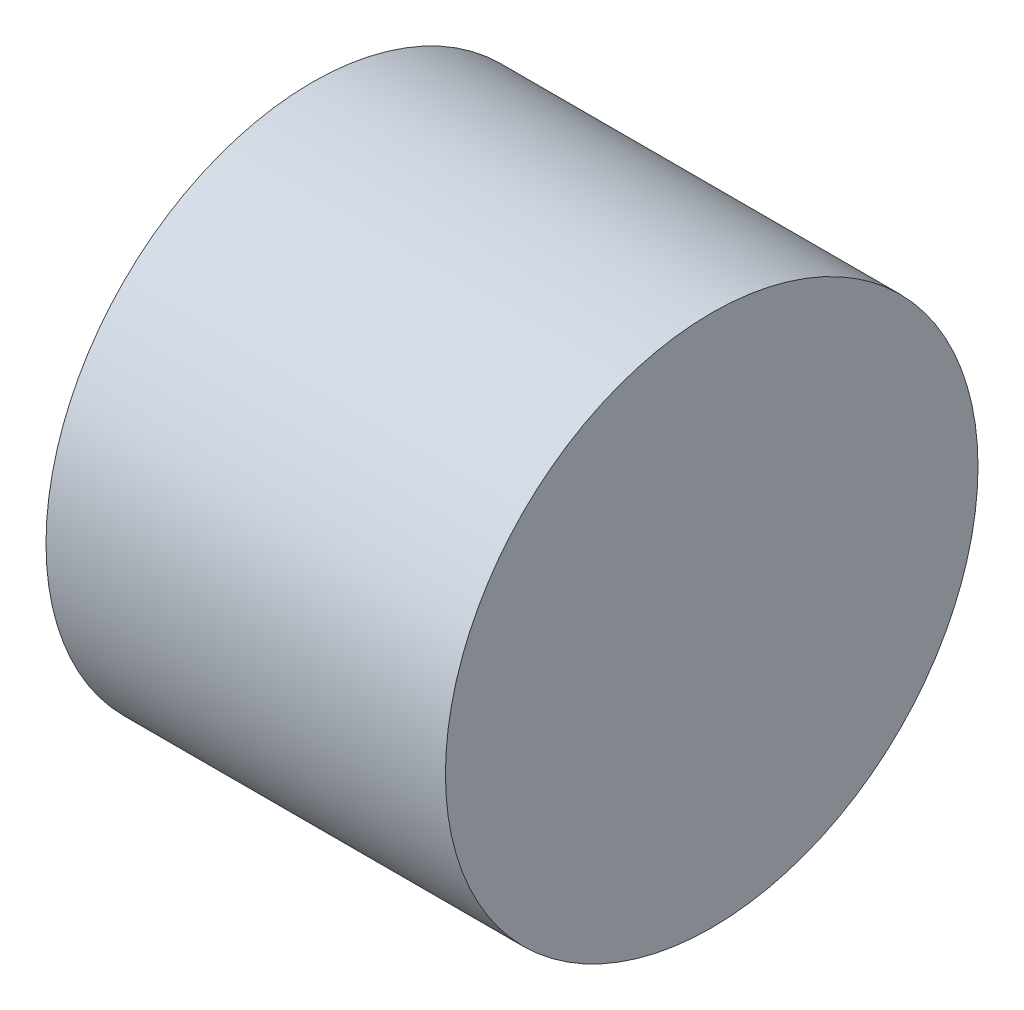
SolidWorks part; units mm, degrees
ref_plane "Plan de face" through (0, 0, 0) normal (0, 0, 1) x (1, 0, 0)
ref_plane "Plan de dessus" through (0, 0, 0) normal (0, 1, 0) x (1, 0, 0)
ref_plane "Plan de droite" through (0, 0, 0) normal (1, 0, 0) x (0, 0, -1)
sketch "Esquisse2" plane through (0, 0, 0) normal (0, 0, 1) x (1, 0, 0)
  line L0 (-39.9719, 0) -> (97.2999, 0) construction
  line L1 (0, 0) -> (60, 0)
  line L2 (0, 0) -> (0, 40)
  line L3 (0, 40) -> (60, 40)
  line L4 (60, 0) -> (60, 40)
  dimension "D1" = 80
  dimension "D2" = 60
revolve "Révolution1" add sketch "Esquisse2" angle 360 about L0
sketch "Esquisse8" [suppressed] plane through (0, 0, 0) normal (0, 0, 1) x (1, 0, 0)
  line L0 (-12.5108, 0) -> (75.6947, 0) construction
  line L1 (33, 46.031) -> (33, 18)
  line L2 (33, 18) -> (59, 18)
  line L3 (59, 18) -> (59, 0)
  line L4 (59, 0) -> (67.631, 0)
  line L5 (67.631, 0) -> (67.631, 50.3229)
  line L6 (67.631, 50.3229) -> (33, 46.031)
  line L8 (60, -40) -> (60, 40) construction
  dimension "D1" = 36
  dimension "D2" = 1
  dimension "D3" = 26
revolve "Enlèvement de matière-Révolution2" [suppressed] cut sketch "Esquisse8" angle 360 about L0
sketch "Esquisse9" [suppressed] plane through (59, 0, 0) normal (1, 0, 0) x (0, 0, -1)
  circle A0 centre (0, 0) radius 8.275
  circle A1 centre (0, 0) radius 18 construction
  dimension "D1" = 16.55
extrude "Enlèv. mat.-Extru.1" [suppressed] cut sketch "Esquisse9" against normal through all
sketch "Esquisse10" plane through (0, 0, 0) normal (0, 0, 1) x (1, 0, 0)
  line L0 (35.3128, 37) -> (22.475, 37)
  line L1 (22.475, 37) -> (22.475, 16)
  line L2 (22.475, 16) -> (1.5, 16)
  line L3 (1.5, 16) -> (1.5, 9.01)
  line L4 (1.5, 9.01) -> (16.5, 9.01)
  line L5 (16.5, 9.01) -> (16.5, 0)
  line L7 (16.5, 0) -> (-6.9066, 0)
  line L8 (-6.9066, 0) -> (-6.9066, 43.7491)
  line L9 (-6.9066, 43.7491) -> (35.3128, 43.7491)
  line L10 (35.3128, 43.7491) -> (35.3128, 37)
  line L11 (71.8724, 0) -> (-25.2629, 0) construction
  line L12 (0, 40) -> (0, -40) construction
  dimension "D1" = 18.02
  dimension "D2" = 32
  dimension "D3" = 74
  dimension "D4" = 1.5
  dimension "D5" = 20.975
  dimension "D6" = 15
revolve "Enlèvement de matière-Révolution3" [suppressed] cut sketch "Esquisse10" angle 360 about L11
chamfer "Chanfrein1" [suppressed] distance 0.2 angle 45
chamfer "Chanfrein2" [suppressed] distance 0.5 angle 45
fillet "Congé1" [suppressed] radius 0.4
chamfer "Chanfrein3" [suppressed] distance 0.5 angle 45
sketch "Esquisse11" [suppressed] plane through (22.475, 0, 0) normal (-1, 0, 0) x (0, 0, 1)
  line L0 (-44.8543, 0) -> (48.2502, 0) construction
  line L1 (-34.5251, 41.1754) -> (38.5946, 41.1754)
  line L2 (-34.5251, 41.1754) -> (-34.5251, 20)
  line L3 (-34.5251, 20) -> (38.5946, 20)
  line L4 (38.5946, 41.1754) -> (38.5946, 20)
  line L5 (-39.053, -20) -> (44.8543, -20)
  line L6 (-39.053, -20) -> (-39.053, -41.4584)
  line L7 (-39.053, -41.4584) -> (44.8543, -41.4584)
  line L8 (44.8543, -20) -> (44.8543, -41.4584)
  dimension "D1" = 20
  dimension "D2" = 40
extrude "Enlèv. mat.-Extru.2" [suppressed] cut sketch "Esquisse11" against normal through all
sketch "Esquisse12" [suppressed] plane through (22.475, 0, 0) normal (-1, 0, 0) x (0, 0, 1)
  line L0 (-39.471, 0) -> (39.3617, 0) construction
  point P3 (-29, 0)
  point P4 (29, 0)
  dimension "D1" = 58
  dimension "D2" = 29
hole_wizard "Diamètre du perçage Ø8.1 (8.1)1" positions "Esquisse3D1" profile "Esquisse13" hole size "Ø8.1" standard "ISO"
sketch3d "Esquisse3D1"
  point P0 (22.475, 0, -29)
  point P3 (22.475, 0, 29)
sketch "Esquisse13" plane through (22.475, 0, -29) normal (0, 1, 0) x (0, 0, 1)
  line L0 (0, 0) -> (0, 16.05)
  line L1 (0, 16.05) -> (4.05, 12)
  line L2 (4.05, 12) -> (4.05, 0)
  line L5 (4.05, 0) -> (0, 0)
  line L10 (0, 16.05) -> (-4.05, 12) construction
  line L11 (0, -6.35) -> (0, 107.95) construction
  dimension "Diamètre du perçage" = 8.1
  dimension "Profondeur du perçage" = 12
  dimension "Angle de pointe" = 90
chamfer "Chanfrein4" [suppressed] distance 0.2 angle 45
sketch "Esquisse14" [suppressed] plane through (0, 0, 0) normal (0, 0, 1) x (1, 0, 0)
  line L0 (30.025, 49.2345) -> (30.025, 17.5)
  line L1 (30.025, 17.5) -> (55, 17.5)
  line L2 (55, 17.5) -> (55, 11)
  line L3 (56, 9.01) -> (41, 9.01)
  line L4 (41, 9.01) -> (41, 0)
  line L5 (41, 0) -> (63.4973, 0)
  line L6 (63.4973, 0) -> (63.4973, 51.5834)
  line L7 (63.4973, 51.5834) -> (30.025, 49.2345)
  line L8 (-7.333, 0) -> (72.2372, 0) construction
  line L9 (22.475, 20) -> (22.475, -20) construction
  line L11 (55, 11) -> (56, 10.4226)
  line L12 (56, 10.4226) -> (56, 9.01)
  line L13 (1.5, 15.5) -> (1.5, -15.5) construction
  dimension "D1" = 18.02
  dimension "D2" = 54.5
  dimension "D3" = 7.55
  dimension "D4" = 1
  dimension "D5" = 35
  dimension "D6" = 30
  dimension "D7" = 22
revolve "Enlèvement de matière-Révolution4" [suppressed] cut sketch "Esquisse14" angle 360 about L8
chamfer "Chanfrein5" [suppressed] distance 0.5 angle 45
chamfer "Chanfrein6" [suppressed] distance 0.2 angle 45
fillet "Congé2" [suppressed] radius 0.4
chamfer "Chanfrein7" [suppressed] distance 0.2 angle 45
chamfer "Chanfrein8" [suppressed] distance 0.5 angle 45
chamfer "Chanfrein9" [suppressed] distance 0.5 angle 45
chamfer "Chanfrein10" [suppressed] distance 0.5 angle 45
